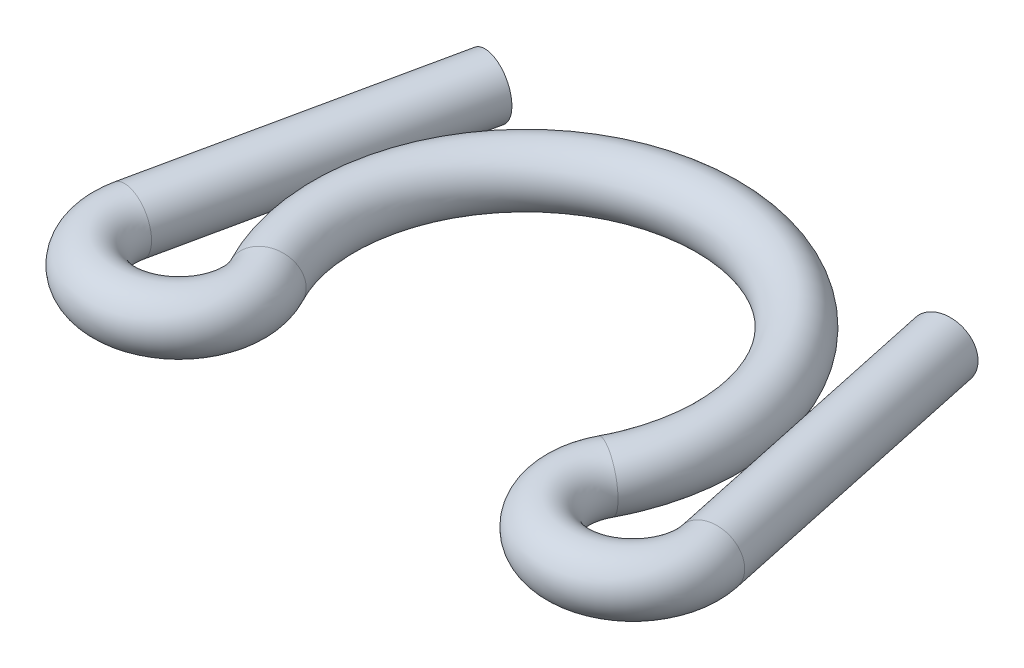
SolidWorks part; units mm, degrees
ref_plane "Front Plane" through (0, 0, 0) normal (0, 0, 1) x (1, 0, 0)
ref_plane "Top Plane" through (0, 0, 0) normal (0, 1, 0) x (1, 0, 0)
ref_plane "Right Plane" through (0, 0, 0) normal (1, 0, 0) x (0, 0, -1)
sketch "Sketch1" plane through (0, 0, 0) normal (0, 1, 0) x (1, 0, 0)
  line L0 (-32.6874, 33.0434) -> (-41.8289, -9.7083)
  line L1 (0, 5.5621) -> (0, 0) construction
  line L2 (32.6874, 33.0434) -> (41.8289, -9.7083)
  arc A0 (-41.8289, -9.7083) -> (-24.4172, -7.3049) centre (-32.6874, -11.663) ccw
  arc A1 (-24.4172, -7.3049) -> (24.4172, -7.3049) centre (0, 5.5621) cw
  arc A2 (41.8289, -9.7083) -> (24.4172, -7.3049) centre (32.6874, -11.663) cw
ref_plane "Plane1" through (-32.6874, 0, -33.0434) normal (-0.2091, 0, 0.9779) x (0.9779, 0, 0.2091)
sketch "Sketch2" plane through (-32.6874, 0, -33.0434) normal (-0.2091, 0, 0.9779) x (0.9779, 0, 0.2091)
  circle A0 centre (0, 0) radius 4.2107
sweep "Sweep3" add profiles "Sketch2" path "Sketch1"
